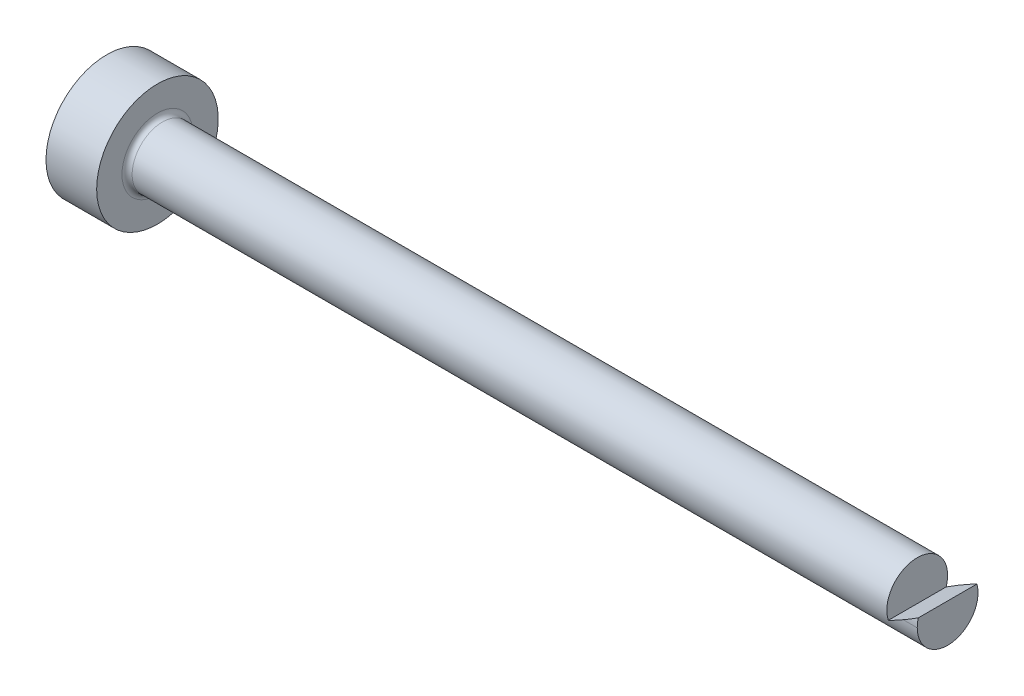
SolidWorks part; units mm, degrees
ref_plane "Face" through (0, 0, 0) normal (0, 0, 1) x (1, 0, 0)
ref_plane "Dessus" through (0, 0, 0) normal (0, 1, 0) x (1, 0, 0)
ref_plane "Droite" through (0, 0, 0) normal (1, 0, 0) x (0, 0, -1)
imported_body "Importée1"
ref_plane "Plan1" through (83, 0, 0) normal (1, 0, 0) x (0, 0, -1)
sketch "Esquisse1" plane through (83, 0, 0) normal (1, 0, 0) x (0, 0, -1)
  circle A0 centre (0, 0) radius 3 construction
  circle A1 centre (0, 0) radius 3
extrude "Enlèv. mat.-Extru.3" cut sketch "Esquisse1" along normal through all
sketch "Esquisse2" plane through (0, 0, 0) normal (0, 0, 1) x (1, 0, 0)
  line L0 (83, 0.8) -> (80, -0.9321)
  line L1 (83, -52.5) -> (83, 52.5) construction
  line L2 (80, -0.9321) -> (80, 3)
  line L3 (83, 3) -> (5.5, 3) construction
  line L4 (80, 3) -> (83, 3)
  line L6 (83, 3) -> (83, 0.8)
  dimension "D1" = 3
  dimension "D2" = 60
  dimension "D3" = 2.2
extrude "Enlèv. mat.-Extru.4" cut sketch "Esquisse2" against normal through all and the other way through all
